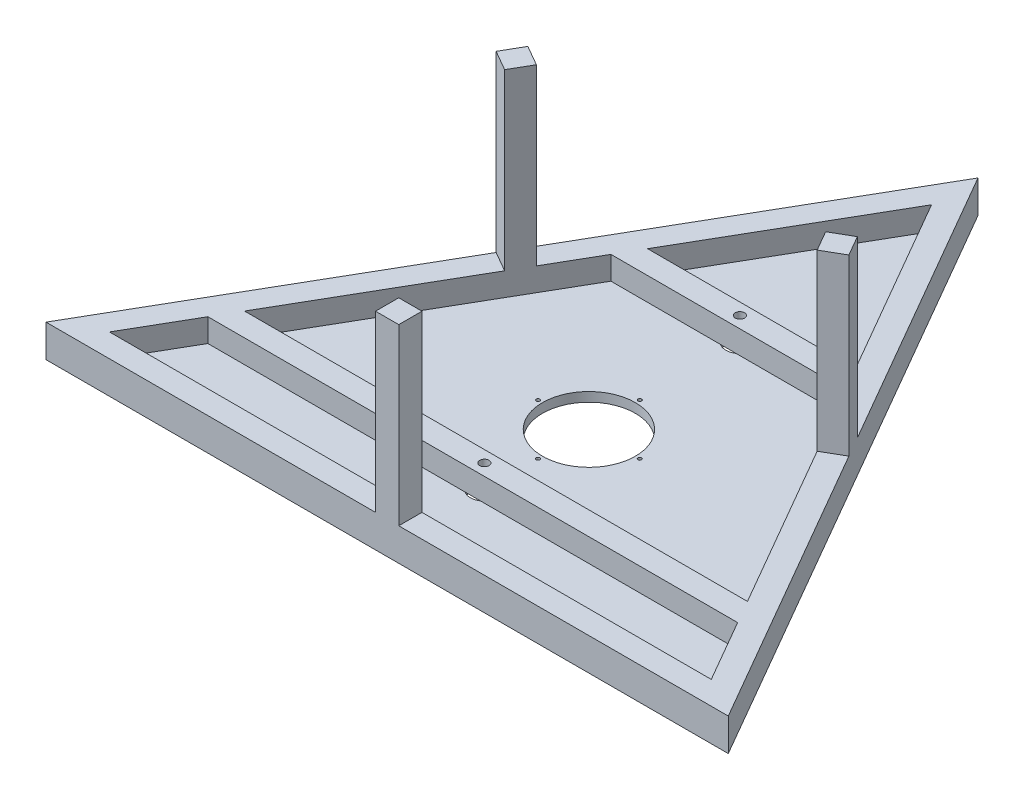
SolidWorks part; units mm, degrees
ref_plane "前视基准面" through (0, 0, 0) normal (0, 0, 1) x (1, 0, 0)
ref_plane "上视基准面" through (0, 0, 0) normal (0, 1, 0) x (1, 0, 0)
ref_plane "右视基准面" through (0, 0, 0) normal (1, 0, 0) x (0, 0, -1)
sketch "草图1" plane through (0, 0, 0) normal (0, 1, 0) x (1, 0, 0)
  line L6 (0, 360) -> (-350, -246.2178)
  line L7 (-350, -246.2178) -> (350, -246.2178)
  line L8 (350, -246.2178) -> (0, 360)
  line L9 (0, 0) -> (0, 360) construction
  line L10 (315.359, -226.2178) -> (0, 320)
  line L11 (0, 320) -> (-315.359, -226.2178)
  line L12 (-315.359, -226.2178) -> (315.359, -226.2178)
  line L13 (293.7083, -213.7178) -> (0, 295)
  line L14 (0, 295) -> (-293.7083, -213.7178)
  line L15 (-293.7083, -213.7178) -> (293.7083, -213.7178)
  line L16 (259.0673, -193.7178) -> (228.0534, -140)
  line L17 (0, 255) -> (-89.4893, 100)
  line L18 (-259.0673, -193.7178) -> (259.0673, -193.7178)
  line L19 (-89.4893, 100) -> (89.4893, 100)
  line L20 (-101.0363, 80) -> (101.0363, 80)
  line L21 (-216.5064, -120) -> (216.5064, -120)
  line L22 (-228.0534, -140) -> (228.0534, -140)
  line L23 (89.4893, 100) -> (0, 255)
  line L24 (259.0673, -193.7178) -> (0, 255) construction
  line L25 (-101.0363, 80) -> (-216.5064, -120)
  line L26 (0, 255) -> (-259.0673, -193.7178) construction
  line L27 (-228.0534, -140) -> (-259.0673, -193.7178)
  line L28 (216.5064, -120) -> (101.0363, 80)
  circle A0 centre (0, 90) radius 4
  circle A1 centre (0, -130) radius 4
  point P26 (0, 0)
  dimension "D1" = 360
  dimension "D10" = 8
  dimension "D12" = 8
  dimension "D3" = 20
  dimension "D2" = 700
  dimension "D6" = 20
  dimension "D7" = 80
  dimension "D8" = 20
  dimension "D9" = 120
  dimension "D11" = 10
  dimension "D13" = 10
  dimension "D4" = 12.5
  dimension "D5" = 20
extrude "凸台-拉伸1" add sketch "草图1" along normal blind 20 contours L22 L27 L18 L16 | L21 L28 L20 L25 | L19 L23 L17 | A0 | A1 | L13 L14 L15
sketch "草图2" plane through (0, 20, 0) normal (0, 1, 0) x (1, 0, 0)
  line L0 (0, 255) -> (-17.3205, 265)
  line L1 (0, 295) -> (-293.7083, -213.7178) construction
  line L2 (-259.0673, -193.7178) -> (-276.3878, -183.7178)
  line L3 (-113.3746, 21.3116) -> (-232.5822, 90.1362) construction
  line L4 (-134.5337, 21.9809) -> (-151.8542, 31.9809)
  line L5 (-101.0363, 80) -> (-216.5064, -120) construction
  line L6 (-124.5337, 39.3014) -> (-141.8542, 49.3014)
  line L7 (-124.5337, 39.3014) -> (-134.5337, 21.9809)
  line L8 (-141.8542, 49.3014) -> (-151.8542, 31.9809)
  line L9 (0, 255) -> (17.3205, 265)
  line L10 (293.7083, -213.7178) -> (0, 295) construction
  line L11 (259.0673, -193.7178) -> (276.3878, -183.7178)
  line L12 (196.7642, 69.4567) -> (-6.8419, -48.0953) construction
  line L13 (141.8542, 49.3014) -> (124.5337, 39.3014)
  line L14 (216.5064, -120) -> (101.0363, 80) construction
  line L15 (151.8542, 31.9809) -> (134.5337, 21.9809)
  line L16 (124.5337, 39.3014) -> (134.5337, 21.9809)
  line L17 (141.8542, 49.3014) -> (151.8542, 31.9809)
  line L18 (0, -159.2134) -> (0, -284.2522) construction
  line L19 (-10, -193.7178) -> (-10, -213.7178)
  line L20 (-259.0673, -193.7178) -> (259.0673, -193.7178) construction
  line L21 (-293.7083, -213.7178) -> (293.7083, -213.7178) construction
  line L22 (10, -193.7178) -> (10, -213.7178)
  line L23 (-10, -193.7178) -> (10, -193.7178)
  line L24 (10, -213.7178) -> (-10, -213.7178)
  point P16 (-143.1939, 26.9809)
  dimension "D1" = 20
  dimension "D2" = 20
  dimension "D3" = 20
extrude "凸台-拉伸2" add sketch "草图2" along normal blind 150 contours L6 L4 M24 M21 | L22 L19 M17 M19 | L13 L16 L15 L17
sketch "草图3" plane through (0, 0, 0) normal (0, -1, 0) x (1, 0, 0)
  line L0 (0, -295) -> (-293.7083, 213.7178)
  line L1 (-293.7083, 213.7178) -> (293.7083, 213.7178)
  line L2 (293.7083, 213.7178) -> (0, -295)
  circle A0 centre (0, 40) radius 40
  circle A1 centre (0, 130) radius 12
  circle A2 centre (0, -90) radius 12
  dimension "D1" = 80
  dimension "D3" = 24
  dimension "D4" = 24
  dimension "D2" = 40
extrude "凸台-拉伸3" add sketch "草图3" along normal blind 8
sketch "草图4" plane through (0, -8, 0) normal (0, -1, 0) x (1, 0, 0)
  line L0 (0, 40) -> (42.25, 40) construction
  line L1 (0, 40) -> (0, 82.25) construction
  circle A0 centre (0, 40) radius 42.25 construction
  circle A1 centre (43.8, 40) radius 1.55
  circle A2 centre (0, -3.8) radius 1.55
  circle A3 centre (-43.8, 40) radius 1.55
  circle A4 centre (0, 83.8) radius 1.55
  point P16 (0, 40)
  dimension "D1" = 84.5
  dimension "D2" = 3.1
  dimension "D3" = 4
extrude "切除-拉伸1" cut sketch "草图4" against normal blind 8
